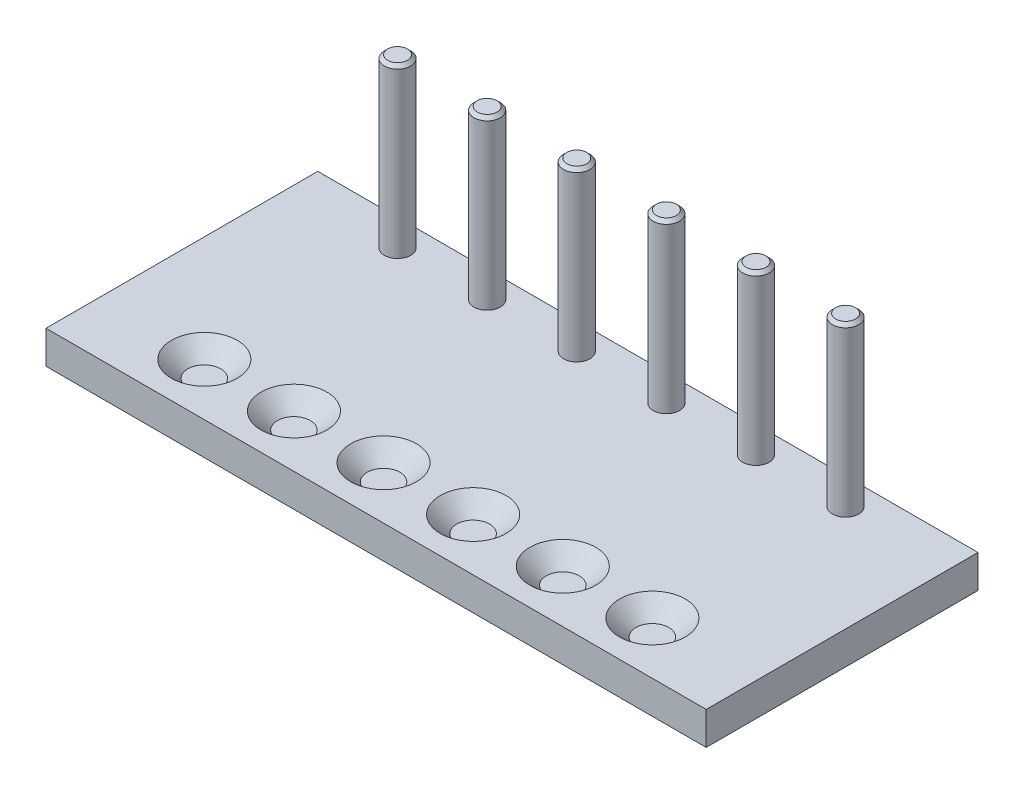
SolidWorks part; units mm, degrees
ref_plane "Front Plane" through (0, 0, 0) normal (0, 0, 1) x (1, 0, 0)
ref_plane "Top Plane" through (0, 0, 0) normal (0, 1, 0) x (1, 0, 0)
ref_plane "Right Plane" through (0, 0, 0) normal (1, 0, 0) x (0, 0, -1)
sketch "Sketch1" plane through (0, 0, 0) normal (0, 1, 0) x (1, 0, 0)
  line L0 (-75.9861, -2.7472) -> (114.5139, -2.7472) construction
  line L1 (-75.9861, 38.5278) -> (114.5139, 38.5278)
  line L2 (-75.9861, 38.5278) -> (-75.9861, -44.0222)
  line L3 (-75.9861, -44.0222) -> (114.5139, -44.0222)
  line L4 (114.5139, 38.5278) -> (114.5139, -44.0222)
  line L7 (5.6571, -24.9722) -> (-75.9861, -24.9722) construction
  line L8 (5.6571, -24.9722) -> (114.5139, -24.9722) construction
  dimension "D1" = 82.55
  dimension "D2" = 190.5
sketch "Sketch2" plane through (0, 0, 0) normal (0, 1, 0) x (1, 0, 0)
  circle A0 centre (87.2997, -28.1472) radius 5
  circle A1 centre (60.0855, -28.1472) radius 5
  circle A2 centre (32.8713, -28.1472) radius 5
  circle A3 centre (5.6565, -28.1472) radius 5
  circle A4 centre (-21.5577, -28.1472) radius 5
  circle A5 centre (-48.7719, -28.1472) radius 5
sketch "Sketch3" plane through (0, 0, 0) normal (0, 1, 0) x (1, 0, 0)
  line L0 (-48.7719, -24.9722) -> (-48.7719, 38.5278) construction
  line L2 (-21.5577, -24.9722) -> (-21.5577, 38.5278) construction
  line L3 (5.6571, -24.9722) -> (5.6571, 38.5278) construction
  line L4 (32.8713, -24.9722) -> (32.8713, 38.5278) construction
  line L5 (60.0855, -24.9722) -> (60.0855, 38.5278) construction
  line L6 (87.2997, -24.9722) -> (87.2997, 38.5278) construction
  line L9 (-75.9861, 30.5278) -> (114.5139, 30.5278) construction
  circle A0 centre (-48.7719, 30.5278) radius 4
  circle A1 centre (-21.5577, 30.5278) radius 4
  circle A2 centre (5.6571, 30.5278) radius 4
  circle A3 centre (32.8713, 30.5278) radius 4
  circle A4 centre (60.0855, 30.5278) radius 4
  circle A5 centre (87.2997, 30.5278) radius 4
  dimension "D1" = 8
  dimension "D2" = 8
  dimension "D3" = 8
  dimension "D4" = 8
  dimension "D5" = 8
  dimension "D6" = 8
extrude "Extrude1" add sketch "Sketch1" against normal blind 10
extrude "Cut-Extrude1" cut sketch "Sketch2" against normal blind 5
extrude "Extrude2" add sketch "Sketch3" along normal blind 50.8
chamfer "Chamfer1" distance 5 angle 45 6 edges at (32.8713, 0, 33.1472) (-48.7719, 0, 33.1472) (-21.5577, 0, 33.1472) (5.6565, 0, 33.1472) (87.2997, 0, 33.1472) (60.0855, 0, 33.1472)
chamfer "Chamfer2" distance 1 angle 45 6 edges at (87.2997, 50.8, -26.5278) (60.0855, 50.8, -26.5278) (32.8713, 50.8, -26.5278) (5.6571, 50.8, -26.5278) (-21.5577, 50.8, -26.5278) (-48.7719, 50.8, -26.5278)
sketch "Sketch4" plane through (0, 0, 0) normal (0, 1, 0) x (1, 0, 0)
  line L1 (-75.9861, 38.5278) -> (-80.9861, 38.5278)
  line L2 (-75.9861, 38.5278) -> (-75.9861, -44.0222)
  line L3 (-75.9861, -44.0222) -> (-80.9861, -44.0222)
  line L4 (-80.9861, 38.5278) -> (-80.9861, -44.0222)
  line L5 (114.5139, 38.5278) -> (119.5139, 38.5278)
  line L6 (114.5139, 38.5278) -> (114.5139, -44.0222)
  line L7 (114.5139, -44.0222) -> (119.5139, -44.0222)
  line L8 (119.5139, 38.5278) -> (119.5139, -44.0222)
  dimension "D1" = 5
  dimension "D2" = 5
extrude "Extrude3" add sketch "Sketch4" against normal blind 10
